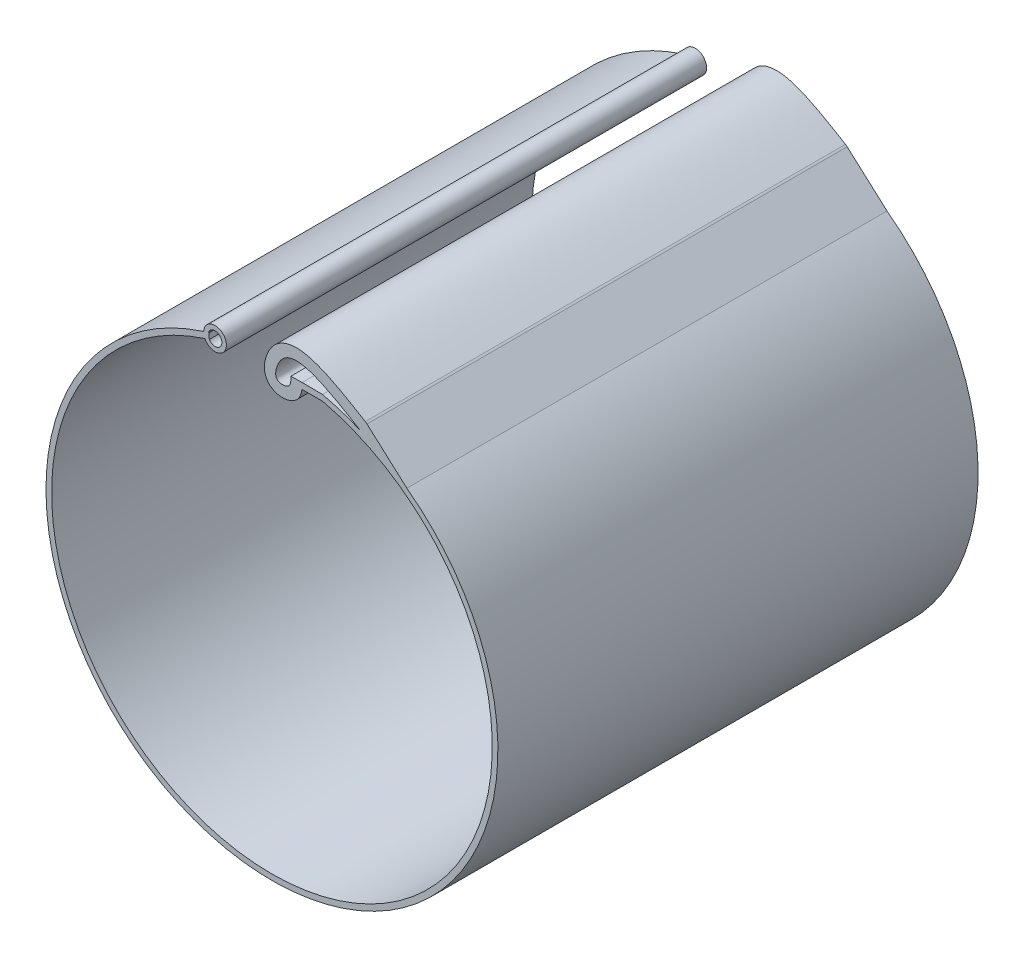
SolidWorks part; units mm, degrees
ref_plane "Front Plane" through (0, 0, 0) normal (0, 0, 1) x (1, 0, 0)
ref_plane "Top Plane" through (0, 0, 0) normal (0, 1, 0) x (1, 0, 0)
ref_plane "Right Plane" through (0, 0, 0) normal (1, 0, 0) x (0, 0, -1)
sketch "Sketch1" plane through (0, 0, 0) normal (0, 0, 1) x (1, 0, 0)
  circle A0 centre (0, 0) radius 50.8
extrude "Extrude1" add sketch "Sketch1" along normal blind 107.95
sketch "Sketch2" plane through (0, 0, 107.95) normal (0, 0, 1) x (1, 0, 0)
  circle A0 centre (0, 0) radius 49.53
extrude "Extrude2" cut sketch "Sketch2" against normal blind 107.95
sketch "Sketch3" plane through (0, 0, 107.95) normal (0, 0, 1) x (1, 0, 0)
  line L0 (-14.0879, 47.4842) -> (11.3969, 48.2009)
  line L1 (-14.0879, 47.4842) -> (-14.1766, 50.6351)
  line L2 (11.3969, 48.2009) -> (11.3083, 51.3518)
  line L3 (-14.1766, 50.6351) -> (11.3083, 51.3518)
  circle A0 centre (0, 0) radius 49.53 construction
extrude "Extrude3" cut sketch "Sketch3" against normal blind 127
sketch "Sketch4" plane through (0, 0, 107.95) normal (0, 0, 1) x (1, 0, 0)
  circle A0 centre (-12.7952, 48.3189) radius 1.5388
  circle A1 centre (-12.7952, 48.3189) radius 2.5548
  dimension "D1" = 1.016
extrude "Extrude4" add sketch "Sketch4" against normal blind 107.95
sketch "Sketch5" plane through (0, 0, 107.95) normal (0, 0, 1) x (1, 0, 0)
  line L0 (4.2438, 49.5135) -> (6.7834, 49.556)
  line L2 (4.2438, 48.2009) -> (4.2438, 49.5135) construction
  line L3 (11.36, 49.5135) -> (11.3969, 48.2009)
  line L5 (21.1856, 48.927) -> (30.3349, 40.7484)
  arc A0 (-15.3478, 48.4261) -> (11.36, 49.5135) centre (0, 0) ccw construction
  arc A1 (19.8784, 46.7492) -> (30.3349, 40.7484) centre (0, 0) cw
  spline S0 degree 3 poles (4.2438, 49.5135) (4.2578, 48.6763) (4.288, 46.8725) (0.4177, 46.7473) (2.3909, 57.2452) (11.6828, 51.6682) (19.8784, 46.7492) knots 0 0 0 0 0.083748 0.180443 0.277138 1 1 1 1
  spline S1 degree 1 poles (6.7834, 49.556) (21.1856, 48.927) knots 0 0 1 1 construction
  spline S2 degree 3 poles (6.7834, 49.556) (6.7864, 49.3812) (6.7922, 49.0585) (6.7759, 48.413) (6.6819, 47.6549) (6.4089, 46.7401) (5.896, 45.9085) (5.2743, 45.3276) (4.631, 44.9013) (3.8455, 44.5841) (2.9282, 44.4075) (2.0089, 44.3913) (1.0576, 44.5479) (0.2095, 44.8862) (-0.4947, 45.3977) (-1.1257, 46.0873) (-1.5669, 47.032) (-1.7212, 48.0294) (-1.6927, 48.8723) (-1.5285, 49.8578) (-1.2126, 50.8702) (-0.7479, 51.947) (-0.145, 52.9385) (0.8406, 54.1022) (2.4107, 55.1808) (4.511, 55.7203) (6.5749, 55.6874) (8.6017, 55.2772) (10.6328, 54.5927) (13.3792, 53.3981) (16.9033, 51.4974) (19.7682, 49.7777) (21.1856, 48.927) knots 0 0 0 0 0.015625 0.03125 0.046875 0.0625 0.078125 0.085938 0.09375 0.109375 0.125 0.140625 0.15625 0.171875 0.179688 0.1875 0.203125 0.21875 0.234375 0.25 0.28125 0.3125 0.34375 0.375 0.4375 0.5 0.5625 0.625 0.6875 0.75 0.875 1 1 1 1
  dimension "D1" = 2.54
extrude "Extrude5" add sketch "Sketch5" against normal up to surface (107.95 mm away) contours S2 L0 S0 L5 M2
sketch "Sketch6" plane through (0, 0, 107.95) normal (0, 0, 1) x (1, 0, 0)
  line L0 (11.36, 49.5135) -> (6.7834, 49.556)
  line L1 (6.7834, 49.556) -> (11.36, 49.5135)
  line L2 (11.3969, 48.2009) -> (6.6078, 48.2009)
  line L3 (6.6078, 48.2009) -> (6.7834, 49.556)
extrude "Extrude6" add sketch "Sketch6" against normal up to surface (107.95 mm away) contours L2 L0 M8 M4
fillet "Fillet1" radius 2.54 1 edges at (21.1856, 48.927, 53.975)
